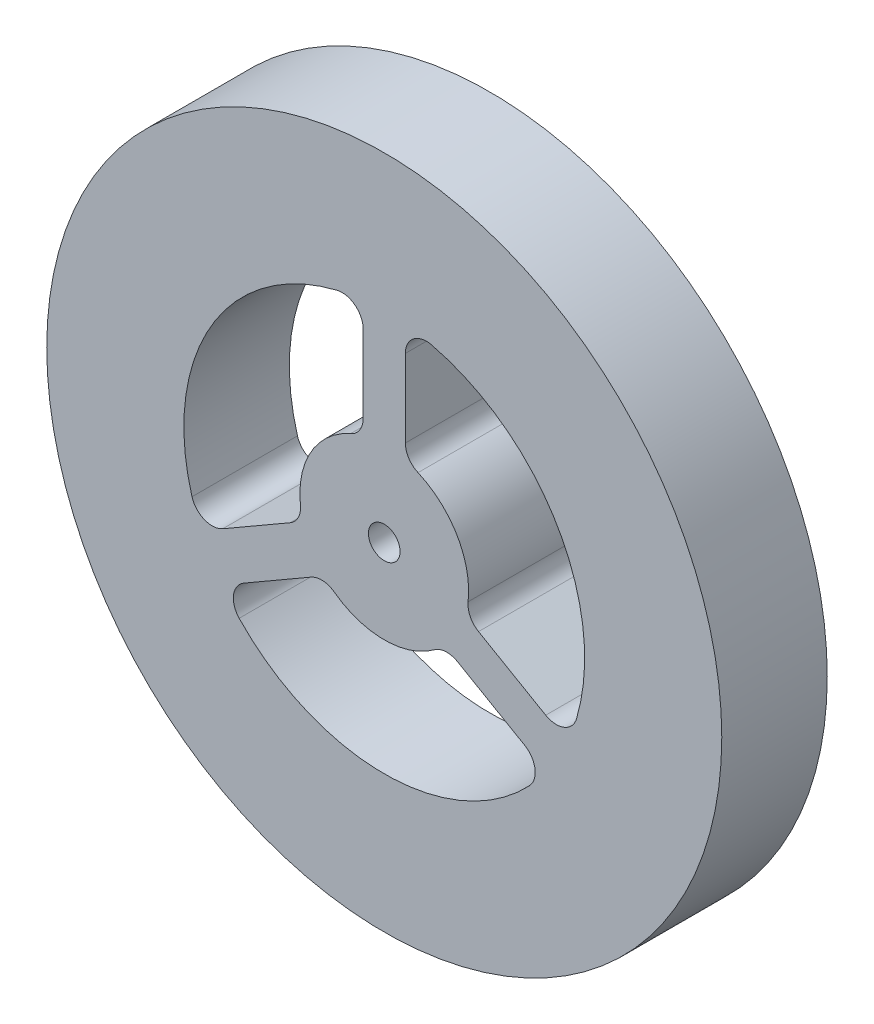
SolidWorks part; units mm, degrees
ref_plane "Спереди" through (0, 0, 0) normal (0, 0, 1) x (1, 0, 0)
ref_plane "Сверху" through (0, 0, 0) normal (0, 1, 0) x (1, 0, 0)
ref_plane "Справа" through (0, 0, 0) normal (1, 0, 0) x (0, 0, -1)
sketch "Эскиз1" plane through (0, 0, 0) normal (0, 0, 1) x (1, 0, 0)
  line L0 (0, 0) -> (0, 16) construction
  line L1 (0, 0) -> (13.8564, -8) construction
  line L2 (0, 0) -> (-13.8564, -8) construction
  line L3 (-1, 9.4472) -> (-1, 0.5774) construction
  line L4 (-1, 0.5774) -> (-8.6815, -3.8576) construction
  line L5 (1, 9.4472) -> (1, 0.5774) construction
  line L6 (1, 0.5774) -> (8.6815, -3.8576) construction
  line L7 (-7.6815, -5.5896) -> (0, -1.1547) construction
  line L8 (0, -1.1547) -> (7.6815, -5.5896) construction
  line L9 (1, 8.2614) -> (1, 4.5826)
  line L10 (4.4686, -1.4253) -> (7.6545, -3.2647)
  line L11 (3.4686, -3.1573) -> (6.6545, -4.9967)
  line L12 (-6.6545, -4.9967) -> (-3.4686, -3.1573)
  line L13 (-7.6545, -3.2647) -> (-4.4686, -1.4253)
  line L14 (-1, 4.5826) -> (-1, 8.2614)
  circle A0 centre (0, 0) radius 16
  circle A1 centre (0, 0) radius 0.75
  arc A2 (-2.2353, 9.2333) -> (-9.1139, -2.6808) centre (0, 0) ccw
  arc A3 (2.2353, 9.2333) -> (9.1139, -2.6808) centre (0, 0) cw
  arc A4 (-6.8786, -6.5525) -> (6.8786, -6.5525) centre (0, 0) ccw
  arc A5 (-1.6, 3.6661) -> (-3.9749, -0.4474) centre (0, 0) ccw
  arc A6 (-2.3749, -3.2187) -> (2.3749, -3.2187) centre (0, 0) ccw
  arc A7 (1.6, 3.6661) -> (3.9749, -0.4474) centre (0, 0) cw
  arc A8 (6.8786, -6.5525) -> (6.6545, -4.9967) centre (6.1545, -5.8627) ccw
  arc A9 (3.4686, -3.1573) -> (2.3749, -3.2187) centre (2.9686, -4.0233) ccw
  arc A10 (-2.3749, -3.2187) -> (-3.4686, -3.1573) centre (-2.9686, -4.0233) ccw
  arc A11 (-6.8786, -6.5525) -> (-6.6545, -4.9967) centre (-6.1545, -5.8627) cw
  arc A12 (-3.9749, -0.4474) -> (-4.4686, -1.4253) centre (-4.9686, -0.5592) cw
  arc A13 (-7.6545, -3.2647) -> (-9.1139, -2.6808) centre (-8.1545, -2.3986) cw
  arc A14 (-2.2353, 9.2333) -> (-1, 8.2614) centre (-2, 8.2614) cw
  arc A15 (-1, 4.5826) -> (-1.6, 3.6661) centre (-2, 4.5826) cw
  arc A16 (1, 4.5826) -> (1.6, 3.6661) centre (2, 4.5826) ccw
  arc A17 (3.9749, -0.4474) -> (4.4686, -1.4253) centre (4.9686, -0.5592) ccw
  arc A18 (7.6545, -3.2647) -> (9.1139, -2.6808) centre (8.1545, -2.3986) ccw
  arc A19 (2.2353, 9.2333) -> (1, 8.2614) centre (2, 8.2614) ccw
  point P27 (2.8541, -2.8025)
  point P30 (-2.8541, -2.8025)
  point P36 (-3.8541, -1.0705)
  point P45 (-1, 3.873)
  point P48 (1, 3.873)
  point P51 (3.8541, -1.0705)
  dimension "D1" = 32
  dimension "D2" = 1.5
  dimension "D5" = 9.5
  dimension "D6" = 9.5
  dimension "D7" = 9.5
  dimension "D14" = 4
  dimension "D15" = 4
  dimension "D16" = 4
  dimension "D17" = 1
  dimension "D3" = 120
  dimension "D4" = 120
  dimension "D8" = 1
  dimension "D9" = 1
  dimension "D10" = 1
  dimension "D11" = 1
  dimension "D12" = 1
  dimension "D13" = 1
extrude "Бобышка-Вытянуть1" add sketch "Эскиз1" along normal blind 5
